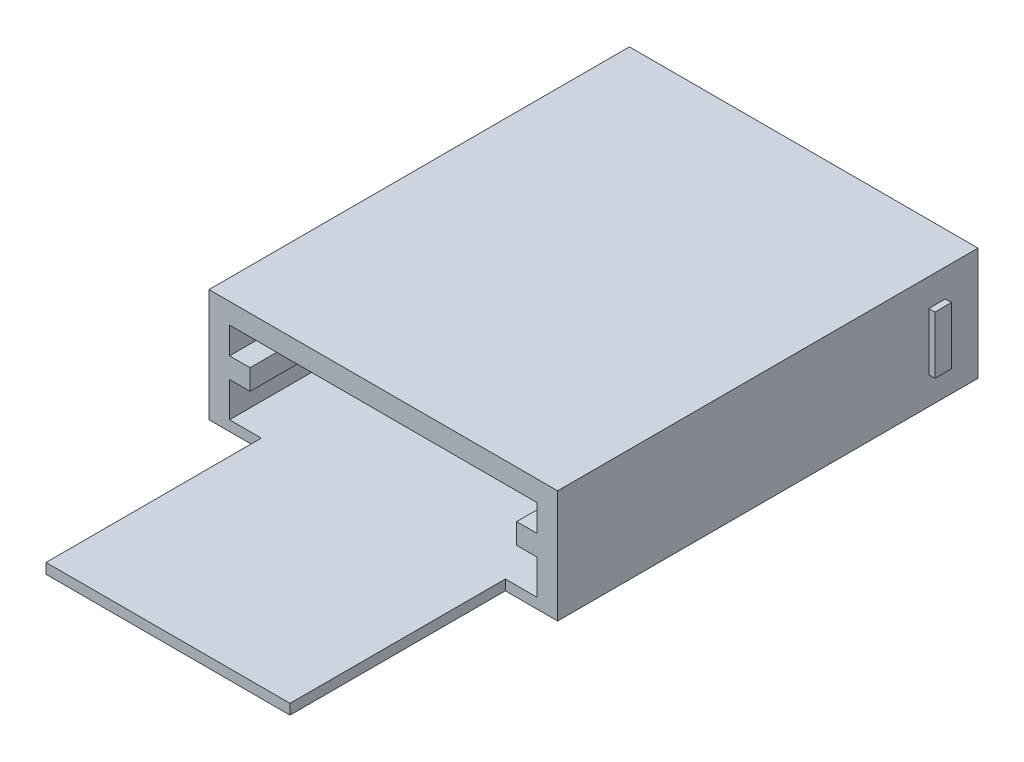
SolidWorks part; units mm, degrees
ref_plane "Front Plane" through (0, 0, 0) normal (0, 0, 1) x (1, 0, 0)
ref_plane "Top Plane" through (0, 0, 0) normal (0, 1, 0) x (1, 0, 0)
ref_plane "Right Plane" through (0, 0, 0) normal (1, 0, 0) x (0, 0, -1)
sketch "Sketch1" plane through (0, 0, 0) normal (0, 1, 0) x (1, 0, 0)
  line L0 (-5.95, -4.5) -> (-7.5, -4.5)
  line L1 (-5.95, -15) -> (5.95, -15)
  line L2 (-7.5, -4.5) -> (-7.5, 15)
  line L3 (-7.5, 15) -> (7.5, 15)
  line L4 (7.5, -4.5) -> (7.5, 15)
  line L8 (-5.95, -15) -> (-5.95, -4.5)
  line L10 (5.95, -15) -> (5.95, -4.5)
  line L13 (5.95, -4.5) -> (7.5, -4.5)
  point P0 (0, 0)
  point P6 (0, -15)
extrude "Boss-Extrude1" add sketch "Sketch1" along normal blind 0.5
sketch "Sketch2" plane through (0, 0.5, 0) normal (0, 1, 0) x (1, 0, 0)
  line L0 (-7.5, -4.5) -> (-7.5, 15)
  line L1 (-7.5, 15) -> (7.5, 15)
  line L2 (7.5, 15) -> (7.5, -4.5)
  line L8 (-7.5, -4.5) -> (-8.5, -4.5)
  line L9 (7.5, -4.5) -> (8.5, -4.5)
  line L16 (8.5, -5.5) -> (8.5, 16)
  line L17 (8.5, 16) -> (-8.5, 16)
  line L18 (-8.5, 16) -> (-8.5, -5.5)
  line L19 (-8.5, -5.5) -> (-6.95, -5.5)
  line L20 (-6.95, -5.5) -> (-6.95, -16)
  line L21 (-6.95, -16) -> (6.95, -16)
  line L22 (6.95, -16) -> (6.95, -5.5)
  line L23 (6.95, -5.5) -> (8.5, -5.5)
  line L24 (8.5, -4.5) -> (8.5, 16)
  line L25 (8.5, 16) -> (-8.5, 16)
  line L26 (-8.5, 16) -> (-8.5, -4.5)
  line L29 (7.5, -4.5) -> (7.5, 15)
  line L30 (7.5, 15) -> (-7.5, 15)
  line L31 (-7.5, 15) -> (-7.5, -4.5)
  line L32 (-7.5, -4.5) -> (-5.95, -4.5)
  line L33 (-5.95, -4.5) -> (-5.95, -15)
  line L34 (-5.95, -15) -> (5.95, -15)
  line L35 (5.95, -15) -> (5.95, -4.5)
  line L36 (5.95, -4.5) -> (7.5, -4.5)
  line L42 (-5.95, -15) -> (5.95, -15)
  dimension "D1" = 1
  dimension "D2" = 0
extrude "Boss-Extrude2" add sketch "Sketch2" along normal blind 5 and the other way blind 0.5 contours L24 L25 L26 L8 L0 L1 L2 L9
sketch "Sketch3" plane through (0, 5.5, 0) normal (0, 1, 0) x (1, 0, 0)
  line L1 (8.5, 16) -> (-8.5, 16)
  line L2 (8.5, 16) -> (8.5, -4.5)
  line L3 (8.5, -4.5) -> (-8.5, -4.5)
  line L4 (-8.5, 16) -> (-8.5, -4.5)
extrude "Boss-Extrude3" add sketch "Sketch3" against normal blind 1
sketch "Sketch4" plane through (0, 0, -16) normal (0, 0, -1) x (-1, 0, 0)
  line L1 (-7.5, 4.5) -> (7.5, 4.5)
  line L2 (-7.5, 4.5) -> (-7.5, 0.5)
  line L3 (-7.5, 0.5) -> (7.5, 0.5)
  line L4 (7.5, 4.5) -> (7.5, 0.5)
extrude "Cut-Extrude1" cut sketch "Sketch4" against normal blind 1
sketch "Sketch6" plane through (8.5, 0, 0) normal (1, 0, 0) x (0, 0, -1)
  line L0 (13.5, 4.25) -> (13.5, 1.25) construction
  line L1 (13.6, 4.15) -> (14.4, 4.15)
  line L2 (13.6, 4.15) -> (13.6, 1.35)
  line L3 (13.6, 1.35) -> (14.4, 1.35)
  line L4 (14.4, 4.15) -> (14.4, 1.35)
  line L5 (14.5, 1.25) -> (14.5, 4.25) construction
  line L6 (14.5, 4.25) -> (13.5, 4.25) construction
  line L7 (13.5, 1.25) -> (14.5, 1.25) construction
  dimension "D1" = 0.1
  dimension "D2" = 0.1
  dimension "D3" = 0.1
  dimension "D4" = 0.1
extrude "Boss-Extrude4" add sketch "Sketch6" along normal blind 0.3
sketch "Sketch7" plane through (-8.5, 0, 0) normal (-1, 0, 0) x (0, 0, 1)
  line L0 (-13.6, 4.15) -> (-13.6, 1.35) construction
  line L1 (-14.4, 4.15) -> (-13.6, 4.15)
  line L2 (-14.4, 4.15) -> (-14.4, 1.35)
  line L3 (-14.4, 1.35) -> (-13.6, 1.35)
  line L4 (-13.6, 4.15) -> (-13.6, 1.35)
extrude "Boss-Extrude5" add sketch "Sketch7" along normal blind 0.3
sketch "Sketch8" plane through (0, 0, 4.5) normal (0, 0, 1) x (1, 0, 0)
  line L0 (-7.5, 0.5) -> (-7.5, 4.5) construction
  line L1 (-7.5, 3.2) -> (-6.5, 3.2)
  line L2 (-7.5, 3.2) -> (-7.5, 2.2)
  line L3 (-7.5, 2.2) -> (-6.5, 2.2)
  line L4 (-6.5, 3.2) -> (-6.5, 2.2)
  line L5 (-6.5, 3.2) -> (-7.5, 3.2) construction
  line L6 (7.5, 0.5) -> (7.5, 4.5) construction
  line L7 (7.5, 3.2) -> (6.5, 3.2)
  line L8 (7.5, 3.2) -> (7.5, 2.2)
  line L9 (7.5, 2.2) -> (6.5, 2.2)
  line L10 (6.5, 3.2) -> (6.5, 2.2)
  line L11 (7.5, 3.2) -> (6.5, 3.2) construction
extrude "Boss-Extrude6" add sketch "Sketch8" against normal blind 20.5
